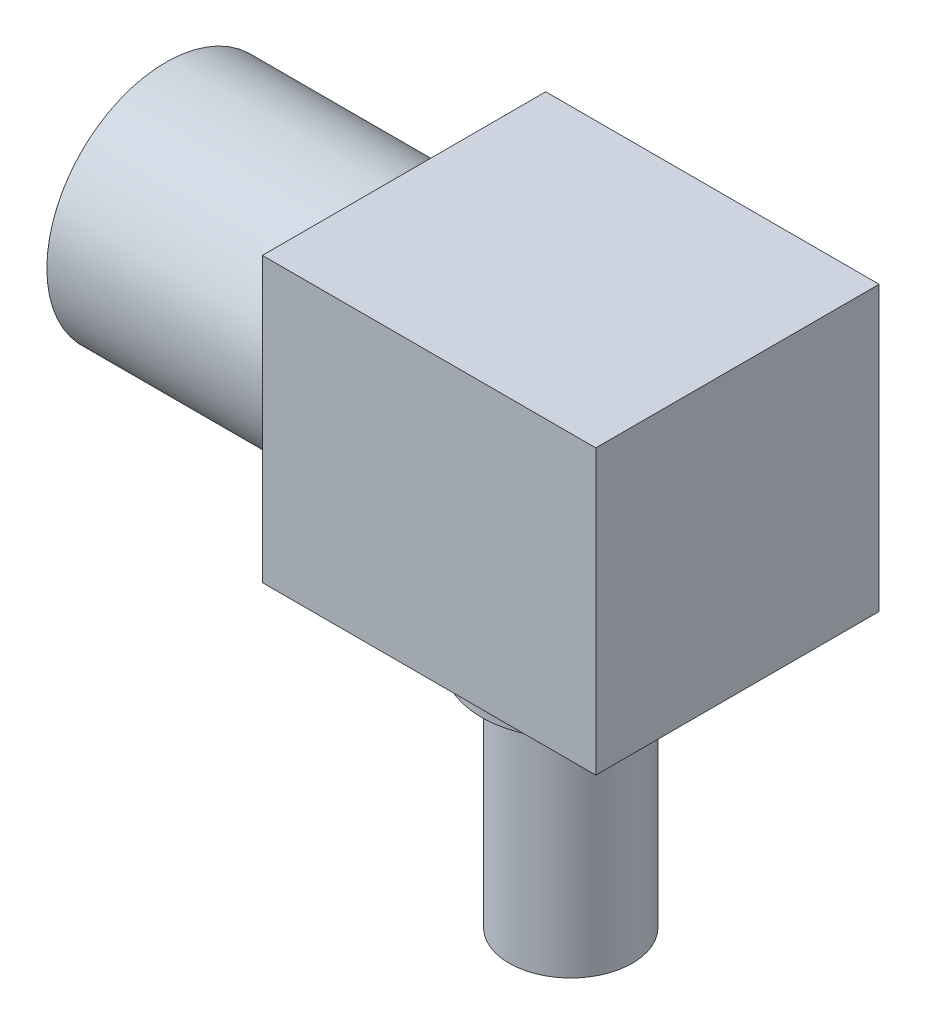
SolidWorks part; units mm, degrees
ref_plane "Front" through (0, 0, 0) normal (0, 0, 1) x (1, 0, 0)
ref_plane "Top" through (0, 0, 0) normal (0, 1, 0) x (1, 0, 0)
ref_plane "Right" through (0, 0, 0) normal (1, 0, 0) x (0, 0, -1)
sketch "Sketch1" plane through (0, 0, 0) normal (1, 0, 0) x (0, 0, -1)
  line L0 (0, 73.4979) -> (0, -93.4936) construction
sketch "Sketch2" plane through (0, 0, 0) normal (0, 1, 0) x (1, 0, 0)
  circle A0 centre (0, 0) radius 7.5
  dimension "D1" = 15
extrude "Extrude1" add sketch "Sketch2" along normal blind 5
sketch "Sketch11" plane through (0, 5, 0) normal (0, 1, 0) x (-1, 0, 0)
  circle A0 centre (0, 0) radius 12.7
  dimension "D1" = 25.4
extrude "Extrude5" [suppressed] add sketch "Sketch11" along normal blind 10
sketch "Sketch3" plane through (0, 0, 0) normal (0, -1, 0) x (1, 0, 0)
  line L0 (14.9492, 0) -> (-16.6875, 0) construction
  line L1 (9.525, -5.4993) -> (9.525, 5.4993)
  line L2 (9.525, 5.4993) -> (0, 10.9985)
  line L3 (9.525, -5.4993) -> (0, -10.9985)
  line L4 (0, 0) -> (0, 17.0332) construction
  line L5 (-9.525, -5.4993) -> (0, -10.9985)
  line L6 (-9.525, -5.4993) -> (-9.525, 5.4993)
  line L7 (-9.525, 5.4993) -> (0, 10.9985)
  point P7 (9.525, 0)
  dimension "D1" = 19.05
  dimension "D2" = 120
extrude "Extrude2" [suppressed] add sketch "Sketch3" along normal blind 6
sketch "Sketch4" plane through (0, 0, 0) normal (0, -1, 0) x (1, 0, 0)
  circle A0 centre (0, 0) radius 5.1752
  dimension "D1" = 10.3503
extrude "THREADS" add sketch "Sketch4" along normal blind 19.05
sketch "Sketch5" plane through (0, 5, 0) normal (0, 1, 0) x (-1, 0, 0)
  line L0 (0, 0) -> (0, -14.9838) construction
  circle A0 centre (0, -8.137) radius 2
  circle A1 centre (0, 0) radius 8.137 construction
  dimension "D1" = 16.2739
  dimension "D2" = 4
extrude "Cut-Extrude1" [suppressed] cut sketch "Sketch5" against normal blind 10
pattern_circular "CirPattern2" [suppressed] count 9 every 36
sketch "Sketch7" [suppressed] plane through (0, 5, 0) normal (0, 1, 0) x (-1, 0, 0)
  line L0 (0, 0) -> (0, -14.0391) construction
  line L1 (0, -8.2489) -> (7.7387, -2.5145) construction
  line L2 (0, 0) -> (1.9347, -2.6908) construction
  line L3 (0, 0) -> (3.8694, -5.3817) construction
  circle A0 centre (1.9347, -2.6908) radius 2
  circle A1 centre (4.7828, 6.5829) radius 2 construction
extrude "Cut-Extrude2" [suppressed] cut sketch "Sketch7" against normal blind 10
sketch "Sketch8" plane through (0, 0, 0) normal (1, 0, 0) x (0, 0, -1)
  line L0 (0, 31.7176) -> (0, -110.4712) construction
  line L1 (0, 73.4979) -> (0, -93.4936) construction
  line L2 (0, 5) -> (0, 0) construction
  line L3 (11.9, 28.8) -> (-11.9, 28.8)
  line L4 (-11.9, 28.8) -> (-11.9, 5)
  line L5 (-11.9, 5) -> (11.9, 5)
  line L6 (7.5, 5) -> (-7.5, 5) construction
  line L7 (11.9, 28.8) -> (11.9, 5)
  point P13 (0, 5)
  point P14 (0, 28.8)
  dimension "D1" = 23.8
  dimension "D2" = 23.8
extrude "Extrude3" add sketch "Sketch8" along normal mid plane 28
sketch "Sketch9" plane through (-14, 0, 0) normal (-1, 0, 0) x (0, 0, 1)
  line L0 (-11.9, 16.9) -> (21.1121, 16.9) construction
  line L1 (-11.9, 5) -> (-11.9, 28.8) construction
  line L2 (0, 6.9) -> (0, 36.5505) construction
  line L3 (0, 73.4979) -> (0, -93.4936) construction
  circle A0 centre (0, 16.9) radius 10
  dimension "D1" = 20
extrude "Extrude4" add sketch "Sketch9" along normal blind 20
sketch "Sketch10" plane through (-34, 0, 0) normal (-1, 0, 0) x (0, 0, 1)
  line L0 (0, 73.4979) -> (0, -93.4936) construction
  line L1 (0, 16.9) -> (6.7309, 16.9) construction
  circle A0 centre (0, 16.9) radius 8 construction
  circle A1 centre (0, 16.9) radius 10 construction
  circle A2 centre (8, 16.9) radius 0.7032
  dimension "D1" = 16
extrude "Cut-Extrude3" cut sketch "Sketch10" against normal blind 10
pattern_circular "CirPattern3" count 8 over 360 about axis through (0, 16.9, 0) along (1, 0, 0) of "Cut-Extrude3"
